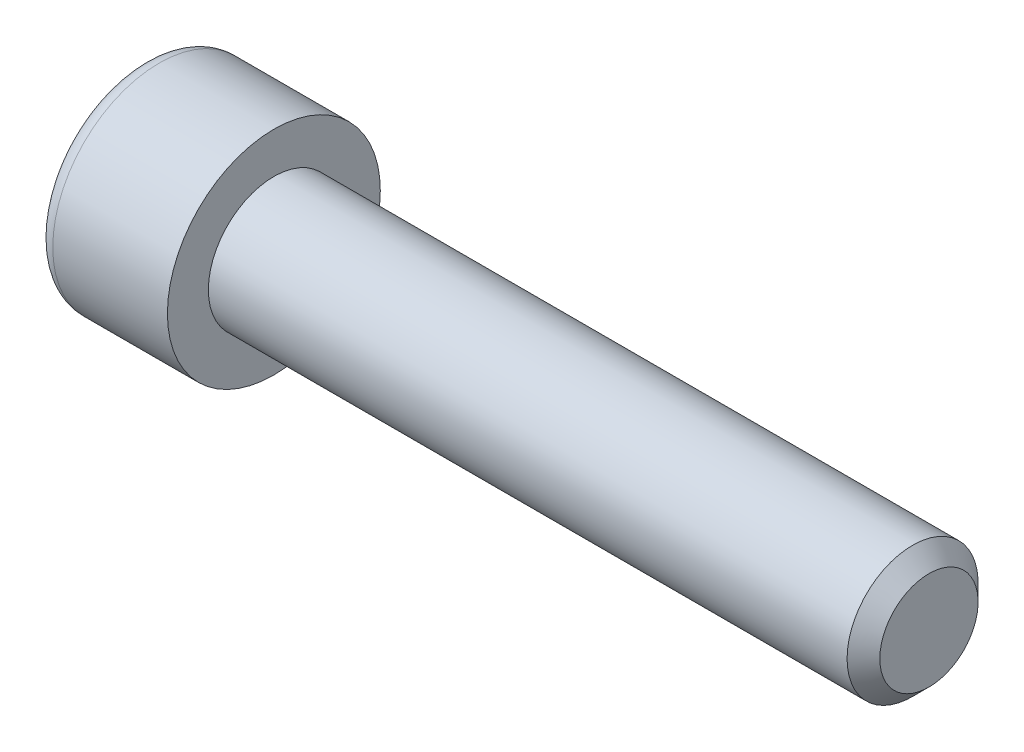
SolidWorks part; units mm, degrees
ref_plane "Plan1" through (0, 0, 0) normal (0, 0, 1) x (1, 0, 0)
ref_plane "Plan2" through (0, 0, 0) normal (0, 1, 0) x (1, 0, 0)
ref_plane "Plan3" through (0, 0, 0) normal (1, 0, 0) x (0, 0, -1)
sketch "Esquisse1" plane through (0, 0, 0) normal (0, 0, 1) x (1, 0, 0)
  line L0 (-28.5762, 0) -> (32.6169, 0) construction
  line L1 (-8, 0) -> (-8, 5.5)
  line L3 (-7, 6.5) -> (0, 6.5)
  line L4 (0, 6.5) -> (0, 4)
  line L5 (0, 4) -> (39, 4)
  line L6 (39, 4) -> (40, 3)
  line L7 (40, 3) -> (40, 0)
  line L8 (40, 0) -> (-8, 0)
  arc A0 (-7, 6.5) -> (-8, 5.5) centre (-7, 5.5) ccw
  dimension "D3" = 1
  dimension "D1" = 1
  dimension "D2" = 1
  dimension "D4" = 40
  dimension "D5" = 6.5
  dimension "D6" = 4
  dimension "D7" = 8
revolve "Base-Révolution" add sketch "Esquisse1" angle 360 about L0
sketch "Esquisse2" plane through (-8, 5.4655, -1.3914) normal (-1, 0, 0) x (0, 0, 1)
  line L4 (-0.3406, -8.5501) -> (-2.0727, -5.5501)
  line L5 (3.1235, -8.5501) -> (-0.3406, -8.5501)
  line L8 (4.8555, -5.5501) -> (3.1235, -8.5501)
  line L9 (-2.0727, -5.5501) -> (-0.3406, -2.5501)
  line L11 (-0.3406, -2.5501) -> (3.1235, -2.5501)
  line L13 (3.1235, -2.5501) -> (4.8555, -5.5501)
  dimension "D1" = 6
extrude "Enlèv. mat.-Extru.1" cut sketch "Esquisse2" against normal blind 4
